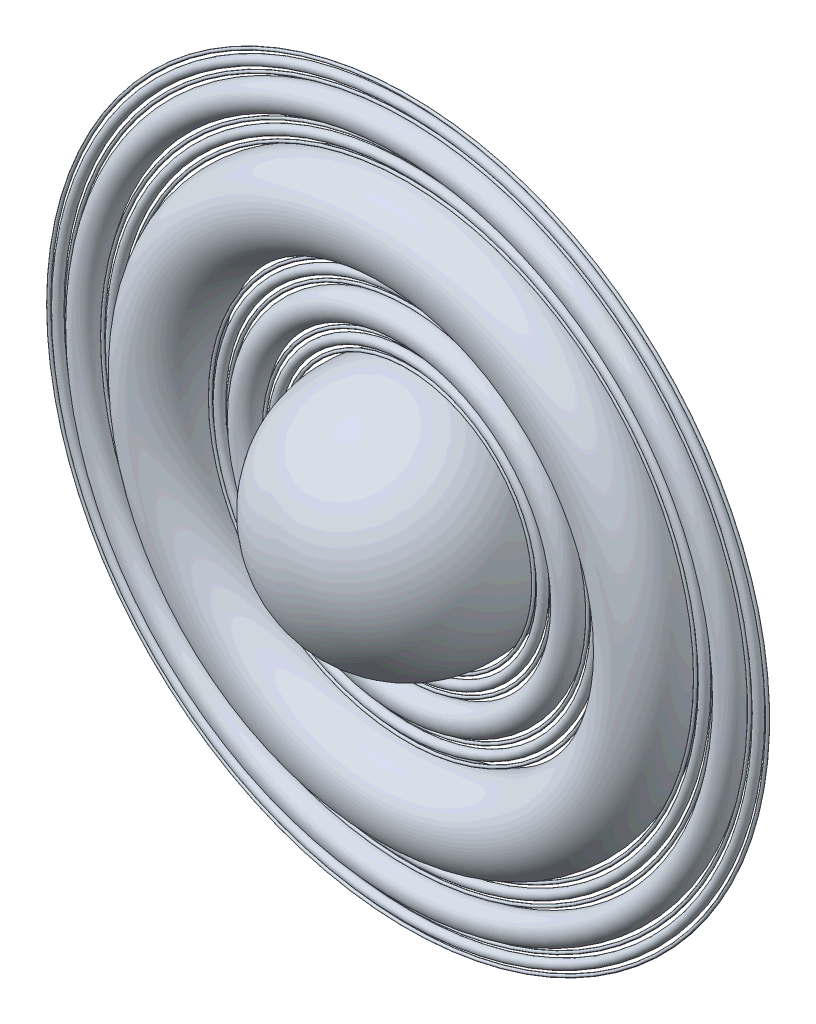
SolidWorks part; units mm, degrees
ref_plane "◯✤ИNⓄᴥ⏀◯✺⦿⚪ꖴ⚪⦿✺◯⏀ᴥⓄИN✤◯" through (0, 0, 0) normal (0, 0, 1) x (1, 0, 0)
ref_plane "◯ߦⓄ✤◯✺⦿⚪ꖴ⚪⦿✺◯✤Ⓞߦ◯" through (0, 0, 0) normal (0, 1, 0) x (1, 0, 0)
ref_plane "◯✤옷ᕤᕦꖴᴥ◯✺⦿⚪ꖴ⚪⦿✺◯ᴥꖴᕤᕦ옷✤◯" through (0, 0, 0) normal (1, 0, 0) x (0, 0, -1)
sketch "◯옷ᑐᑕ✤ᗱᗴ✻ᔓᔕ◯ИNⓄꖴ✤ᑐᑕᗱᗴᔓᔕ◯ᗱᗴᴥᗱᗴ옷ߦᔓᔕ◯✤ИNⓄᴥ⏀◯✺⦿⚪ꖴ⚪⦿✺◯⏀ᴥⓄИN✤◯ᔓᔕߦ옷ᗱᗴᴥᗱᗴ◯ᔓᔕᗱᗴᑐᑕ✤ꖴⓄИN◯ᔓᔕ✻ᗱᗴ✤ᑐᑕ옷◯" plane through (0, 0, 0) normal (0, 0, 1) x (1, 0, 0)
  line L0 (0, 0) -> (0, 0.5) construction
  line L1 (0, 0) -> (0.3536, 0.3536) construction
  line L2 (0, 0) -> (0.5, 0) construction
  line L3 (0, 0) -> (0.3536, -0.3536) construction
  line L4 (0, 0) -> (0, -0.5) construction
  line L5 (0, 0) -> (-0.3536, -0.3536) construction
  line L6 (0, 0) -> (-0.5, 0) construction
  line L7 (0, 0) -> (-0.3536, 0.3536) construction
  circle A0 centre (0, 0) radius 0.5 construction
  point P13 (0, 0)
  dimension "D1" = 8
sketch "◯옷ᑐᑕ✤ᗱᗴ✻ᔓᔕ◯ИNⓄꖴ✤ᑐᑕᗱᗴᔓᔕ◯ᗱᗴᴥᗱᗴ옷ߦᔓᔕ◯✤옷ᕤᕦꖴᴥ◯✺⦿⚪ꖴ⚪⦿✺◯ᴥꖴᕤᕦ옷✤◯ᔓᔕߦ옷ᗱᗴᴥᗱᗴ◯ᔓᔕᗱᗴᑐᑕ✤ꖴⓄИN◯ᔓᔕ✻ᗱᗴ✤ᑐᑕ옷◯" plane through (0, 0, 0) normal (1, 0, 0) x (0, 0, -1)
  line L0 (0, -0.5) -> (0, 0.5) construction
  line L1 (0, 0) -> (-0.5, 0) construction
  line L2 (-0.3536, 0.3536) -> (0, 0) construction
  line L3 (-0.3536, -0.3536) -> (0, 0) construction
  arc A0 (0, 0.5) -> (-0.5, 0) centre (0, 0) ccw construction
  arc A1 (0, -0.5) -> (-0.5, 0) centre (0, 0) cw construction
sketch "◯옷ᑐᑕ✤ᗱᗴ✻ᔓᔕ◯ИNⓄꖴ✤ᑐᑕᗱᗴᔓᔕ◯ᗱᗴᴥᗱᗴ옷ߦᔓᔕ◯ߦⓄ✤◯✺⦿⚪ꖴ⚪⦿✺◯✤Ⓞߦ◯ᔓᔕߦ옷ᗱᗴᴥᗱᗴ◯ᔓᔕᗱᗴᑐᑕ✤ꖴⓄИN◯ᔓᔕ✻ᗱᗴ✤ᑐᑕ옷◯" plane through (0, 0, 0) normal (0, 1, 0) x (1, 0, 0)
  line L0 (0.5, 0) -> (-0.5, 0) construction
  line L1 (0, 0) -> (0, -0.5) construction
  line L2 (-0.3536, -0.3536) -> (0, 0) construction
  line L3 (0.3536, -0.3536) -> (0, 0) construction
  arc A0 (-0.5, 0) -> (0, -0.5) centre (0, 0) ccw construction
  arc A1 (0.5, 0) -> (0, -0.5) centre (0, 0) cw construction
ref_plane "◯✤옷ᕤᕦꖴᴥ◯ߦⓄ✤◯✺⦿⚪ꖴ⚪⦿✺◯✤Ⓞߦ◯ᴥꖴᕤᕦ옷✤◯" through (0, 0, 0) normal (-0.7071, 0.7071, 0) x (0.7071, 0.7071, 0)
ref_plane "◯✤⏀ᗱᗴᙁ◯ߦⓄ✤◯✺⦿⚪ꖴ⚪⦿✺◯✤Ⓞߦ◯ᙁᗱᗴ⏀✤◯" through (0, 0, 0) normal (0.7071, 0.7071, 0) x (0.7071, -0.7071, 0)
ref_plane "◯·◯ߦⓄ✤◯✤ИNⓄᴥ⏀◯✺⦿⚪ꖴ⚪⦿✺◯⏀ᴥⓄИN✤◯✤Ⓞߦ◯·◯" through (0, 0, 0) normal (0, 0.7071, 0.7071) x (1, 0, 0)
ref_plane "◯✤옷ᕤᕦꖴᴥ◯✤ИNⓄᴥ⏀◯✺⦿⚪ꖴ⚪⦿✺◯⏀ᴥⓄИN✤◯ᴥꖴᕤᕦ옷✤◯" through (0, 0, 0) normal (0.7071, 0, 0.7071) x (0.7071, 0, -0.7071)
ref_plane "◯ߦⓄ✤◯✤ИNⓄᴥ⏀◯✺⦿⚪ꖴ⚪⦿✺◯⏀ᴥⓄИN✤◯✤Ⓞߦ◯" through (0, 0, 0) normal (0, -0.7071, 0.7071) x (1, 0, 0)
ref_plane "◯·◯✤옷ᕤᕦꖴᴥ◯✤ИNⓄᴥ⏀◯✺⦿⚪ꖴ⚪⦿✺◯⏀ᴥⓄИN✤◯ᴥꖴᕤᕦ옷✤◯·◯" through (0, 0, 0) normal (-0.7071, 0, 0.7071) x (0.7071, 0, 0.7071)
sketch "◯옷ᑐᑕ✤ᗱᗴ✻ᔓᔕ◯ИNⓄꖴ✤ᑐᑕᗱᗴᔓᔕ◯ᗱᗴᴥᗱᗴ옷ߦᔓᔕ◯·◯ߦⓄ✤◯✤ИNⓄᴥ⏀◯✺⦿⚪ꖴ⚪⦿✺◯⏀ᴥⓄИN✤◯✤Ⓞߦ◯·◯ᔓᔕߦ옷ᗱᗴᴥᗱᗴ◯ᔓᔕᗱᗴᑐᑕ✤ꖴⓄИN◯ᔓᔕ✻ᗱᗴ✤ᑐᑕ옷◯" plane through (0, 0, 0) normal (0, 0.7071, 0.7071) x (1, 0, 0)
  line L0 (-0.2887, -0.4082) -> (0, 0) construction
  line L1 (0.2887, -0.4082) -> (0, 0) construction
  arc A0 (-0.2887, -0.4082) -> (0.2887, -0.4082) centre (0, 0) ccw construction
sketch "◯옷ᑐᑕ✤ᗱᗴ✻ᔓᔕ◯ИNⓄꖴ✤ᑐᑕᗱᗴᔓᔕ◯ᗱᗴᴥᗱᗴ옷ߦᔓᔕ◯✤옷ᕤᕦꖴᴥ◯✤ИNⓄᴥ⏀◯✺⦿⚪ꖴ⚪⦿✺◯⏀ᴥⓄИN✤◯ᴥꖴᕤᕦ옷✤◯ᔓᔕߦ옷ᗱᗴᴥᗱᗴ◯ᔓᔕᗱᗴᑐᑕ✤ꖴⓄИN◯ᔓᔕ✻ᗱᗴ✤ᑐᑕ옷◯" plane through (0, 0, 0) normal (0.7071, 0, 0.7071) x (0.7071, 0, -0.7071)
  line L0 (-0.4082, -0.2887) -> (0, 0) construction
  line L1 (-0.4082, -0.2887) -> (0, 0) construction
  line L2 (-0.4082, 0.2887) -> (0, 0) construction
  arc A0 (-0.4082, 0.2887) -> (-0.4082, -0.2887) centre (0, 0) ccw construction
sketch "◯옷ᑐᑕ✤ᗱᗴ✻ᔓᔕ◯ИNⓄꖴ✤ᑐᑕᗱᗴᔓᔕ◯ᗱᗴᴥᗱᗴ옷ߦᔓᔕ◯ߦⓄ✤◯✤ИNⓄᴥ⏀◯✺⦿⚪ꖴ⚪⦿✺◯⏀ᴥⓄИN✤◯✤Ⓞߦ◯ᔓᔕߦ옷ᗱᗴᴥᗱᗴ◯ᔓᔕᗱᗴᑐᑕ✤ꖴⓄИN◯ᔓᔕ✻ᗱᗴ✤ᑐᑕ옷◯" plane through (0, 0, 0) normal (0, -0.7071, 0.7071) x (1, 0, 0)
  line L0 (-0.2887, 0.4082) -> (0, 0) construction
  line L1 (-0.2887, 0.4082) -> (0, 0) construction
  line L2 (0.2887, 0.4082) -> (0, 0) construction
  arc A0 (0.2887, 0.4082) -> (-0.2887, 0.4082) centre (0, 0) ccw construction
sketch "◯옷ᑐᑕ✤ᗱᗴ✻ᔓᔕ◯ИNⓄꖴ✤ᑐᑕᗱᗴᔓᔕ◯ᗱᗴᴥᗱᗴ옷ߦᔓᔕ◯·◯✤옷ᕤᕦꖴᴥ◯✤ИNⓄᴥ⏀◯✺⦿⚪ꖴ⚪⦿✺◯⏀ᴥⓄИN✤◯ᴥꖴᕤᕦ옷✤◯·◯ᔓᔕߦ옷ᗱᗴᴥᗱᗴ◯ᔓᔕᗱᗴᑐᑕ✤ꖴⓄИN◯ᔓᔕ✻ᗱᗴ✤ᑐᑕ옷◯" plane through (0, 0, 0) normal (-0.7071, 0, 0.7071) x (0.7071, 0, 0.7071)
  line L0 (0.4082, 0.2887) -> (0, 0) construction
  line L1 (0.4082, -0.2887) -> (0, 0) construction
  line L2 (0.4082, 0.2887) -> (0, 0) construction
  line L3 (0.4082, -0.2887) -> (0, 0) construction
  arc A0 (0.4082, -0.2887) -> (0.4082, 0.2887) centre (0, 0) ccw construction
other "Freeze***"
sketch "Sketch0" plane through (0, 0, 0) normal (0, 0, 1) x (1, 0, 0)
  line L0 (3280.5, 0) -> (-3280.5, 0)
  arc A0 (3280.5, 0) -> (-3280.5, 0) centre (0, 0) ccw
revolve "0" add sketch "Sketch0" angle 360 about L0
sketch "Sketch730" plane through (0, 0, 0) normal (0, 1, 0) x (1, 0, 0)
  line L4 (0, 5467.5) -> (0, 7654.5) construction
  circle A3 centre (6561, 0) radius 1093.5
revolve "0 +1" add sketch "Sketch730" angle 360 about L4
sketch "Sketch731" plane through (0, 0, 0) normal (0, 1, 0) x (1, 0, 0)
  line L6 (0, 4738.5) -> (0, 4009.5) construction
  circle A3 centre (4374, 0) radius 364.5
  point P4 (0, 0)
revolve "2 -1" add sketch "Sketch731" angle 360 about L6
sketch "Sketch732" plane through (0, 0, 0) normal (0, 1, 0) x (1, 0, 0)
  line L4 (0, 9112.5) -> (0, 8383.5) construction
  circle A3 centre (8748, 0) radius 364.5
revolve "2 +1" add sketch "Sketch732" angle 360 about L4
sketch "Sketch733" plane through (0, 0, 0) normal (0, 1, 0) x (1, 0, 0)
  line L4 (0, 3766.5) -> (0, 3523.5) construction
  circle A3 centre (3645, 0) radius 121.5
  point P1 (0, 0)
revolve "3 -2 -1" add sketch "Sketch733" angle 360 about L4
sketch "Sketch734" plane through (0, 0, 0) normal (0, 1, 0) x (1, 0, 0)
  line L4 (0, 5224.5) -> (0, 4981.5) construction
  circle A3 centre (5103, 0) radius 121.5
revolve "3 +2 -1" add sketch "Sketch734" angle 360 about L4
sketch "Sketch735" plane through (0, 0, 0) normal (0, 1, 0) x (1, 0, 0)
  line L4 (0, 8140.5) -> (0, 7897.5) construction
  circle A3 centre (8019, 0) radius 121.5
revolve "3 -2 +1" add sketch "Sketch735" angle 360 about L4
sketch "Sketch736" plane through (0, 0, 0) normal (0, 1, 0) x (1, 0, 0)
  line L4 (0, 9598.5) -> (0, 9355.5) construction
  circle A3 centre (9477, 0) radius 121.5
revolve "3 +2 +1" add sketch "Sketch736" angle 360 about L4
sketch "Sketch737" plane through (0, 0, 0) normal (0, 1, 0) x (1, 0, 0)
  line L4 (0, 3442.5) -> (0, 3361.5) construction
  circle A3 centre (3402, 0) radius 40.5
revolve "4 -3 -2 -1" add sketch "Sketch737" angle 360 about L4
sketch "Sketch738" plane through (0, 0, 0) normal (0, 1, 0) x (1, 0, 0)
  line L4 (0, 3928.5) -> (0, 3847.5) construction
  circle A3 centre (3888, 0) radius 40.5
revolve "4 +3 -2 -1" add sketch "Sketch738" angle 360 about L4
sketch "Sketch739" plane through (0, 0, 0) normal (0, 1, 0) x (1, 0, 0)
  line L4 (0, 4900.5) -> (0, 4819.5) construction
  circle A3 centre (4860, 0) radius 40.5
revolve "4 -3 +2 -1" add sketch "Sketch739" angle 360 about L4
sketch "Sketch740" plane through (0, 0, 0) normal (0, 1, 0) x (1, 0, 0)
  line L4 (0, 5386.5) -> (0, 5305.5) construction
  circle A3 centre (5346, 0) radius 40.5
revolve "4 +3 +2 -1" add sketch "Sketch740" angle 360 about L4
sketch "Sketch741" plane through (0, 0, 0) normal (0, 1, 0) x (1, 0, 0)
  line L4 (0, 7816.5) -> (0, 7735.5) construction
  circle A3 centre (7776, 0) radius 40.5
revolve "4 -3 -2 +1" add sketch "Sketch741" angle 360 about L4
sketch "Sketch742" plane through (0, 0, 0) normal (0, 1, 0) x (1, 0, 0)
  line L4 (0, 8302.5) -> (0, 8221.5) construction
  circle A3 centre (8262, 0) radius 40.5
revolve "4 +3 -2 +1" add sketch "Sketch742" angle 360 about L4
sketch "Sketch743" plane through (0, 0, 0) normal (0, 1, 0) x (1, 0, 0)
  line L4 (0, 9274.5) -> (0, 9193.5) construction
  circle A3 centre (9234, 0) radius 40.5
revolve "4 -3 +2 +1" add sketch "Sketch743" angle 360 about L4
sketch "Sketch744" plane through (0, 0, 0) normal (0, 1, 0) x (1, 0, 0)
  line L4 (0, 9760.5) -> (0, 9679.5) construction
  circle A3 centre (9720, 0) radius 40.5
revolve "4 +3 +2 +1" add sketch "Sketch744" angle 360 about L4
sketch "Sketch1" plane through (0, 0, 0) normal (0, 0, 1) x (1, 0, 0)
  circle A0 centre (0, 0) radius 3280.5
  circle A1 centre (0, 0) radius 9841.5
extrude "Boss-Extrude1" [suppressed] add sketch "Sketch1" along normal mid plane 1 separate body
sketch "Sketch3" plane through (0, 0, 0) normal (0, 0, 1) x (1, 0, 0)
  circle A2 centre (0, 0) radius 9841.5 construction
  circle A3 centre (0, 0) radius 3280.5 construction
  circle A4 centre (0, 0) radius 6561 construction
  circle A5 centre (0, 0) radius 7654.5
  circle A6 centre (0, 0) radius 5467.5
extrude "Boss-Extrude3" [suppressed] add sketch "Sketch3" along normal mid plane 3 separate body
sketch "Sketch9" [suppressed] plane through (0, 0, 0) normal (0, 0, 1) x (1, 0, 0)
  line L0 (-3280.5, 0) -> (-5467.5, 0) construction
  line L1 (-7654.5, 0) -> (-9841.5, 0) construction
  circle A0 centre (0, 0) radius 5467.5 construction
  circle A1 centre (0, 0) radius 7654.5
  circle A2 centre (0, 0) radius 7654.5 construction
  circle A3 centre (0, 0) radius 5467.5 construction
  circle A4 centre (0, 0) radius 3280.5 construction
  circle A5 centre (0, 0) radius 3280.5 construction
  circle A6 centre (0, 0) radius 9841.5 construction
  circle A7 centre (0, 0) radius 4374 construction
  circle A8 centre (0, 0) radius 8748 construction
  circle A9 centre (0, 0) radius 4738.5
  circle A10 centre (0, 0) radius 9112.5
  circle A11 centre (0, 0) radius 4009.5
  circle A12 centre (0, 0) radius 8383.5
  point P15 (-4374, 0)
  point P16 (-8748, 0)
  dimension "D1" = 0
extrude "Boss-Extrude9" [suppressed] add sketch "Sketch9" along normal mid plane 9 separate body contours A9 A11 | A10 A12
sketch "Sketch27" [suppressed] plane through (0, 0, 0) normal (0, 0, 1) x (1, 0, 0)
  line L0 (-7654.5, 0) -> (-8383.5, 0) construction
  line L1 (-9112.5, 0) -> (-9841.5, 0) construction
  line L2 (-4738.5, 0) -> (-5467.5, 0) construction
  line L3 (-3280.5, 0) -> (-4009.5, 0) construction
  circle A0 centre (0, 0) radius 8383.5 construction
  circle A1 centre (0, 0) radius 9112.5 construction
  circle A2 centre (0, 0) radius 8383.5 construction
  circle A3 centre (0, 0) radius 9112.5 construction
  circle A4 centre (0, 0) radius 4009.5 construction
  circle A5 centre (0, 0) radius 4738.5 construction
  circle A6 centre (0, 0) radius 4009.5 construction
  circle A7 centre (0, 0) radius 4738.5 construction
  circle A8 centre (0, 0) radius 9841.5 construction
  circle A9 centre (0, 0) radius 9841.5 construction
  circle A10 centre (0, 0) radius 7654.5 construction
  circle A11 centre (0, 0) radius 7654.5 construction
  circle A12 centre (0, 0) radius 3280.5 construction
  circle A13 centre (0, 0) radius 5467.5 construction
  circle A14 centre (0, 0) radius 3280.5 construction
  circle A15 centre (0, 0) radius 5467.5 construction
  circle A16 centre (0, 0) radius 3645 construction
  circle A17 centre (0, 0) radius 5103 construction
  circle A18 centre (0, 0) radius 8019 construction
  circle A19 centre (0, 0) radius 9477 construction
  circle A20 centre (0, 0) radius 3766.5
  circle A21 centre (0, 0) radius 5224.5
  circle A22 centre (0, 0) radius 8140.5
  circle A23 centre (0, 0) radius 9598.5
  circle A24 centre (0, 0) radius 3523.5
  circle A25 centre (0, 0) radius 4981.5
  circle A26 centre (0, 0) radius 7897.5
  circle A27 centre (0, 0) radius 9355.5
  point P28 (-8019, 0)
  point P29 (-9477, 0)
  point P34 (-3645, 0)
  point P35 (-5103, 0)
extrude "Boss-Extrude27" [suppressed] add sketch "Sketch27" along normal mid plane 27 separate body contours A20 A24 | A21 A25 | A22 A26 | A23 A27
sketch "Sketch81" [suppressed] plane through (0, 0, 0) normal (0, 0, 1) x (1, 0, 0)
  line L0 (-3280.5, 0) -> (-3523.5, 0) construction
  line L1 (-3766.5, 0) -> (-4009.5, 0) construction
  line L2 (-4738.5, 0) -> (-4981.5, 0) construction
  line L3 (-5224.5, 0) -> (-5467.5, 0) construction
  line L4 (-7654.5, 0) -> (-7897.5, 0) construction
  line L5 (-8140.5, 0) -> (-8383.5, 0) construction
  line L6 (-9112.5, 0) -> (-9355.5, 0) construction
  line L7 (-9598.5, 0) -> (-9841.5, 0) construction
  circle A0 centre (0, 0) radius 3523.5 construction
  circle A1 centre (0, 0) radius 3280.5 construction
  circle A2 centre (0, 0) radius 3523.5 construction
  circle A3 centre (0, 0) radius 3280.5 construction
  circle A4 centre (0, 0) radius 3402 construction
  circle A5 centre (0, 0) radius 4009.5 construction
  circle A6 centre (0, 0) radius 3766.5 construction
  circle A7 centre (0, 0) radius 4009.5 construction
  circle A8 centre (0, 0) radius 3766.5 construction
  circle A9 centre (0, 0) radius 3888 construction
  circle A10 centre (0, 0) radius 4981.5 construction
  circle A11 centre (0, 0) radius 4738.5 construction
  circle A12 centre (0, 0) radius 4981.5 construction
  circle A13 centre (0, 0) radius 4738.5 construction
  circle A15 centre (0, 0) radius 4860 construction
  circle A16 centre (0, 0) radius 5467.5 construction
  circle A17 centre (0, 0) radius 5224.5 construction
  circle A18 centre (0, 0) radius 5467.5 construction
  circle A19 centre (0, 0) radius 5224.5 construction
  circle A20 centre (0, 0) radius 5346 construction
  circle A21 centre (0, 0) radius 7897.5 construction
  circle A22 centre (0, 0) radius 7654.5 construction
  circle A23 centre (0, 0) radius 7897.5 construction
  circle A24 centre (0, 0) radius 7654.5 construction
  circle A25 centre (0, 0) radius 8383.5 construction
  circle A26 centre (0, 0) radius 8140.5 construction
  circle A27 centre (0, 0) radius 8383.5 construction
  circle A28 centre (0, 0) radius 8140.5 construction
  circle A29 centre (0, 0) radius 9355.5 construction
  circle A30 centre (0, 0) radius 9112.5 construction
  circle A31 centre (0, 0) radius 9355.5 construction
  circle A32 centre (0, 0) radius 9112.5 construction
  circle A33 centre (0, 0) radius 9841.5 construction
  circle A34 centre (0, 0) radius 9598.5 construction
  circle A35 centre (0, 0) radius 9841.5 construction
  circle A36 centre (0, 0) radius 9598.5 construction
  circle A37 centre (0, 0) radius 7776 construction
  circle A38 centre (0, 0) radius 8262 construction
  circle A39 centre (0, 0) radius 9234 construction
  circle A40 centre (0, 0) radius 9720 construction
  circle A41 centre (0, 0) radius 3442.5
  circle A42 centre (0, 0) radius 3928.5
  circle A43 centre (0, 0) radius 4900.5
  circle A44 centre (0, 0) radius 5386.5
  circle A45 centre (0, 0) radius 7816.5
  circle A46 centre (0, 0) radius 8302.5
  circle A47 centre (0, 0) radius 9274.5
  circle A48 centre (0, 0) radius 9760.5
  circle A49 centre (0, 0) radius 3361.5
  circle A50 centre (0, 0) radius 3847.5
  circle A51 centre (0, 0) radius 4819.5
  circle A52 centre (0, 0) radius 5305.5
  circle A53 centre (0, 0) radius 7735.5
  circle A54 centre (0, 0) radius 8221.5
  circle A55 centre (0, 0) radius 9193.5
  circle A56 centre (0, 0) radius 9679.5
  point P8 (-3402, 0)
  point P18 (-3888, 0)
  point P28 (-4860, 0)
  point P38 (-5346, 0)
  point P48 (-7776, 0)
  point P57 (-8262, 0)
  point P66 (-9234, 0)
  point P75 (-9720, 0)
extrude "Boss-Extrude81" [suppressed] add sketch "Sketch81" along normal mid plane 81 separate body contours A41 A49 | A42 A50 | A43 A51 | A44 A52 | A45 A53 | A46 A54 | A47 A55 | A48 A56
sketch "Sketch243" [suppressed] plane through (0, 0, 0) normal (0, 0, 1) x (1, 0, 0)
  line L0 (-3280.5, 0) -> (-3361.5, 0) construction
  line L1 (-3442.5, 0) -> (-3523.5, 0) construction
  line L2 (-3766.5, 0) -> (-3847.5, 0) construction
  line L3 (-3928.5, 0) -> (-4009.5, 0) construction
  line L4 (-4738.5, 0) -> (-4819.5, 0) construction
  line L5 (-4900.5, 0) -> (-4981.5, 0) construction
  line L6 (-5224.5, 0) -> (-5305.5, 0) construction
  line L7 (-5386.5, 0) -> (-5467.5, 0) construction
  line L8 (-7654.5, 0) -> (-7735.5, 0) construction
  line L9 (-7816.5, 0) -> (-7897.5, 0) construction
  line L10 (-8140.5, 0) -> (-8221.5, 0) construction
  line L11 (-8302.5, 0) -> (-8383.5, 0) construction
  line L12 (-9112.5, 0) -> (-9193.5, 0) construction
  line L13 (-9274.5, 0) -> (-9355.5, 0) construction
  line L14 (-9598.5, 0) -> (-9679.5, 0) construction
  line L15 (-9760.5, 0) -> (-9841.5, 0) construction
  circle A0 centre (0, 0) radius 3361.5 construction
  circle A1 centre (0, 0) radius 3280.5 construction
  circle A2 centre (0, 0) radius 3361.5 construction
  circle A3 centre (0, 0) radius 3280.5 construction
  circle A4 centre (0, 0) radius 3523.5 construction
  circle A5 centre (0, 0) radius 3442.5 construction
  circle A6 centre (0, 0) radius 3523.5 construction
  circle A7 centre (0, 0) radius 3442.5 construction
  circle A8 centre (0, 0) radius 3847.5 construction
  circle A9 centre (0, 0) radius 3766.5 construction
  circle A10 centre (0, 0) radius 3847.5 construction
  circle A11 centre (0, 0) radius 3766.5 construction
  circle A12 centre (0, 0) radius 4009.5 construction
  circle A13 centre (0, 0) radius 3928.5 construction
  circle A14 centre (0, 0) radius 4009.5 construction
  circle A15 centre (0, 0) radius 3928.5 construction
  circle A16 centre (0, 0) radius 4819.5 construction
  circle A17 centre (0, 0) radius 4738.5 construction
  circle A18 centre (0, 0) radius 4819.5 construction
  circle A19 centre (0, 0) radius 4738.5 construction
  circle A20 centre (0, 0) radius 4981.5 construction
  circle A21 centre (0, 0) radius 4900.5 construction
  circle A22 centre (0, 0) radius 4981.5 construction
  circle A23 centre (0, 0) radius 4900.5 construction
  circle A24 centre (0, 0) radius 5467.5 construction
  circle A25 centre (0, 0) radius 5386.5 construction
  circle A26 centre (0, 0) radius 5305.5 construction
  circle A27 centre (0, 0) radius 5224.5 construction
  circle A28 centre (0, 0) radius 5467.5 construction
  circle A29 centre (0, 0) radius 5386.5 construction
  circle A30 centre (0, 0) radius 5305.5 construction
  circle A31 centre (0, 0) radius 5224.5 construction
  circle A32 centre (0, 0) radius 7735.5 construction
  circle A33 centre (0, 0) radius 7654.5 construction
  circle A34 centre (0, 0) radius 7735.5 construction
  circle A35 centre (0, 0) radius 7654.5 construction
  circle A36 centre (0, 0) radius 8383.5 construction
  circle A37 centre (0, 0) radius 8302.5 construction
  circle A38 centre (0, 0) radius 8221.5 construction
  circle A39 centre (0, 0) radius 8140.5 construction
  circle A40 centre (0, 0) radius 7897.5 construction
  circle A41 centre (0, 0) radius 7816.5 construction
  circle A42 centre (0, 0) radius 8383.5 construction
  circle A43 centre (0, 0) radius 8302.5 construction
  circle A44 centre (0, 0) radius 8221.5 construction
  circle A45 centre (0, 0) radius 8140.5 construction
  circle A46 centre (0, 0) radius 7897.5 construction
  circle A47 centre (0, 0) radius 7816.5 construction
  circle A48 centre (0, 0) radius 9760.5 construction
  circle A49 centre (0, 0) radius 9841.5
  circle A50 centre (0, 0) radius 9841.5 construction
  circle A51 centre (0, 0) radius 9679.5 construction
  circle A52 centre (0, 0) radius 9598.5 construction
  circle A53 centre (0, 0) radius 9355.5 construction
  circle A54 centre (0, 0) radius 9274.5 construction
  circle A55 centre (0, 0) radius 9193.5 construction
  circle A56 centre (0, 0) radius 9112.5 construction
  circle A57 centre (0, 0) radius 9760.5 construction
  circle A58 centre (0, 0) radius 9679.5 construction
  circle A59 centre (0, 0) radius 9598.5 construction
  circle A60 centre (0, 0) radius 9355.5 construction
  circle A61 centre (0, 0) radius 9274.5 construction
  circle A62 centre (0, 0) radius 9193.5 construction
  circle A63 centre (0, 0) radius 9112.5 construction
  circle A64 centre (0, 0) radius 3321 construction
  circle A65 centre (0, 0) radius 3483 construction
  circle A66 centre (0, 0) radius 3807 construction
  circle A67 centre (0, 0) radius 3969 construction
  circle A68 centre (0, 0) radius 4779 construction
  circle A69 centre (0, 0) radius 4941 construction
  circle A70 centre (0, 0) radius 5265 construction
  circle A71 centre (0, 0) radius 5427 construction
  circle A72 centre (0, 0) radius 7695 construction
  circle A73 centre (0, 0) radius 7857 construction
  circle A74 centre (0, 0) radius 8181 construction
  circle A75 centre (0, 0) radius 8343 construction
  circle A76 centre (0, 0) radius 9153 construction
  circle A77 centre (0, 0) radius 9315 construction
  circle A78 centre (0, 0) radius 9639 construction
  circle A79 centre (0, 0) radius 9801 construction
  circle A80 centre (0, 0) radius 3334.5
  circle A81 centre (0, 0) radius 3496.5
  circle A82 centre (0, 0) radius 3820.5
  circle A83 centre (0, 0) radius 3982.5
  circle A84 centre (0, 0) radius 4792.5
  circle A85 centre (0, 0) radius 4954.5
  circle A86 centre (0, 0) radius 5278.5
  circle A87 centre (0, 0) radius 5440.5
  circle A88 centre (0, 0) radius 7708.5
  circle A89 centre (0, 0) radius 7870.5
  circle A90 centre (0, 0) radius 8194.5
  circle A91 centre (0, 0) radius 8356.5
  circle A92 centre (0, 0) radius 9166.5
  circle A93 centre (0, 0) radius 9328.5
  circle A94 centre (0, 0) radius 9652.5
  circle A95 centre (0, 0) radius 9814.5
  circle A96 centre (0, 0) radius 3307.5
  circle A97 centre (0, 0) radius 3469.5
  circle A98 centre (0, 0) radius 3793.5
  circle A99 centre (0, 0) radius 3955.5
  circle A100 centre (0, 0) radius 4765.5
  circle A101 centre (0, 0) radius 4927.5
  circle A102 centre (0, 0) radius 5251.5
  circle A103 centre (0, 0) radius 5413.5
  circle A104 centre (0, 0) radius 7681.5
  circle A105 centre (0, 0) radius 7843.5
  circle A106 centre (0, 0) radius 8167.5
  circle A107 centre (0, 0) radius 8329.5
  circle A108 centre (0, 0) radius 9139.5
  circle A109 centre (0, 0) radius 9301.5
  circle A110 centre (0, 0) radius 9625.5
  circle A111 centre (0, 0) radius 9787.5
  point P8 (-3321, 0)
  point P17 (-3483, 0)
  point P26 (-3807, 0)
  point P35 (-3969, 0)
  point P68 (-4779, 0)
  point P69 (-4941, 0)
  point P70 (-5265, 0)
  point P71 (-5427, 0)
  point P136 (-7695, 0)
  point P137 (-7857, 0)
  point P138 (-8181, 0)
  point P139 (-8343, 0)
  point P140 (-9153, 0)
  point P141 (-9315, 0)
  point P142 (-9639, 0)
  point P143 (-9801, 0)
  dimension "D1" = 0
extrude "Boss-Extrude243" [suppressed] add sketch "Sketch243" along normal mid plane 243 separate body contours A80 A96 | A81 A97 | A82 A98 | A83 A99 | A84 A100 | A85 A101 | A86 A102 | A87 A103 | A88 A104 | A89 A105 | A90 A106 | A91 A107 | A92 A108 | A93 A109 | A94 A110 | A95 A111
sketch "Sketch729" [suppressed] plane through (0, 0, 0) normal (0, 0, 1) x (1, 0, 0)
  line L0 (-3280.5, 0) -> (-3307.5, 0) construction
  line L1 (-3334.5, 0) -> (-3361.5, 0) construction
  line L2 (-3442.5, 0) -> (-3469.5, 0) construction
  line L3 (-3496.5, 0) -> (-3523.5, 0) construction
  line L4 (-3766.5, 0) -> (-3793.5, 0) construction
  line L5 (-3820.5, 0) -> (-3847.5, 0) construction
  line L6 (-3928.5, 0) -> (-3955.5, 0) construction
  line L7 (-3982.5, 0) -> (-4009.5, 0) construction
  line L8 (-4738.5, 0) -> (-4765.5, 0) construction
  line L9 (-4792.5, 0) -> (-4819.5, 0) construction
  line L10 (-4900.5, 0) -> (-4927.5, 0) construction
  line L11 (-4954.5, 0) -> (-4981.5, 0) construction
  line L12 (-5224.5, 0) -> (-5251.5, 0) construction
  line L13 (-5278.5, 0) -> (-5305.5, 0) construction
  line L14 (-5386.5, 0) -> (-5413.5, 0) construction
  line L15 (-5440.5, 0) -> (-5467.5, 0) construction
  line L16 (-7654.5, 0) -> (-7681.5, 0) construction
  line L17 (-7708.5, 0) -> (-7735.5, 0) construction
  line L18 (-7816.5, 0) -> (-7843.5, 0) construction
  line L19 (-7870.5, 0) -> (-7897.5, 0) construction
  line L20 (-8140.5, 0) -> (-8167.5, 0) construction
  line L21 (-8194.5, 0) -> (-8221.5, 0) construction
  line L22 (-8302.5, 0) -> (-8329.5, 0) construction
  line L23 (-8356.5, 0) -> (-8383.5, 0) construction
  line L24 (-9112.5, 0) -> (-9139.5, 0) construction
  line L25 (-9166.5, 0) -> (-9193.5, 0) construction
  line L26 (-9274.5, 0) -> (-9301.5, 0) construction
  line L27 (-9328.5, 0) -> (-9355.5, 0) construction
  line L28 (-9598.5, 0) -> (-9625.5, 0) construction
  line L29 (-9652.5, 0) -> (-9679.5, 0) construction
  line L30 (-9760.5, 0) -> (-9787.5, 0) construction
  line L31 (-9814.5, 0) -> (-9841.5, 0) construction
  circle A0 centre (0, 0) radius 4009.5 construction
  circle A1 centre (0, 0) radius 3280.5
  circle A2 centre (0, 0) radius 3280.5 construction
  circle A3 centre (0, 0) radius 3982.5 construction
  circle A4 centre (0, 0) radius 3955.5 construction
  circle A5 centre (0, 0) radius 3928.5 construction
  circle A6 centre (0, 0) radius 3847.5 construction
  circle A7 centre (0, 0) radius 3820.5 construction
  circle A8 centre (0, 0) radius 3793.5 construction
  circle A9 centre (0, 0) radius 3766.5 construction
  circle A10 centre (0, 0) radius 3523.5 construction
  circle A11 centre (0, 0) radius 3496.5 construction
  circle A12 centre (0, 0) radius 3469.5 construction
  circle A13 centre (0, 0) radius 3442.5 construction
  circle A14 centre (0, 0) radius 3361.5 construction
  circle A15 centre (0, 0) radius 3334.5 construction
  circle A16 centre (0, 0) radius 3307.5 construction
  circle A17 centre (0, 0) radius 4009.5 construction
  circle A18 centre (0, 0) radius 3982.5 construction
  circle A19 centre (0, 0) radius 3955.5 construction
  circle A20 centre (0, 0) radius 3928.5 construction
  circle A21 centre (0, 0) radius 3847.5 construction
  circle A22 centre (0, 0) radius 3820.5 construction
  circle A23 centre (0, 0) radius 3793.5 construction
  circle A24 centre (0, 0) radius 3766.5 construction
  circle A25 centre (0, 0) radius 3523.5 construction
  circle A26 centre (0, 0) radius 3496.5 construction
  circle A27 centre (0, 0) radius 3469.5 construction
  circle A28 centre (0, 0) radius 3442.5 construction
  circle A29 centre (0, 0) radius 3361.5 construction
  circle A30 centre (0, 0) radius 3334.5 construction
  circle A31 centre (0, 0) radius 3307.5 construction
  circle A32 centre (0, 0) radius 5467.5 construction
  circle A33 centre (0, 0) radius 9841.5
  circle A34 centre (0, 0) radius 9841.5 construction
  circle A35 centre (0, 0) radius 5440.5 construction
  circle A36 centre (0, 0) radius 5413.5 construction
  circle A37 centre (0, 0) radius 5386.5 construction
  circle A38 centre (0, 0) radius 5305.5 construction
  circle A39 centre (0, 0) radius 5278.5 construction
  circle A40 centre (0, 0) radius 5251.5 construction
  circle A41 centre (0, 0) radius 5224.5 construction
  circle A42 centre (0, 0) radius 4981.5 construction
  circle A43 centre (0, 0) radius 4954.5 construction
  circle A44 centre (0, 0) radius 4927.5 construction
  circle A45 centre (0, 0) radius 4900.5 construction
  circle A46 centre (0, 0) radius 4819.5 construction
  circle A47 centre (0, 0) radius 4792.5 construction
  circle A48 centre (0, 0) radius 4765.5 construction
  circle A49 centre (0, 0) radius 4738.5 construction
  circle A50 centre (0, 0) radius 5467.5 construction
  circle A51 centre (0, 0) radius 5440.5 construction
  circle A52 centre (0, 0) radius 5413.5 construction
  circle A53 centre (0, 0) radius 5386.5 construction
  circle A54 centre (0, 0) radius 5305.5 construction
  circle A55 centre (0, 0) radius 5278.5 construction
  circle A56 centre (0, 0) radius 5251.5 construction
  circle A57 centre (0, 0) radius 5224.5 construction
  circle A58 centre (0, 0) radius 4981.5 construction
  circle A59 centre (0, 0) radius 4954.5 construction
  circle A60 centre (0, 0) radius 4927.5 construction
  circle A61 centre (0, 0) radius 4900.5 construction
  circle A62 centre (0, 0) radius 4819.5 construction
  circle A63 centre (0, 0) radius 4792.5 construction
  circle A64 centre (0, 0) radius 4765.5 construction
  circle A65 centre (0, 0) radius 4738.5 construction
  circle A66 centre (0, 0) radius 8383.5 construction
  circle A67 centre (0, 0) radius 9814.5 construction
  circle A68 centre (0, 0) radius 3294 construction
  circle A69 centre (0, 0) radius 8356.5 construction
  circle A70 centre (0, 0) radius 8329.5 construction
  circle A71 centre (0, 0) radius 8302.5 construction
  circle A72 centre (0, 0) radius 8221.5 construction
  circle A73 centre (0, 0) radius 8194.5 construction
  circle A74 centre (0, 0) radius 8167.5 construction
  circle A75 centre (0, 0) radius 8140.5 construction
  circle A76 centre (0, 0) radius 7897.5 construction
  circle A77 centre (0, 0) radius 7870.5 construction
  circle A78 centre (0, 0) radius 7843.5 construction
  circle A79 centre (0, 0) radius 7816.5 construction
  circle A80 centre (0, 0) radius 7735.5 construction
  circle A81 centre (0, 0) radius 7708.5 construction
  circle A82 centre (0, 0) radius 7681.5 construction
  circle A83 centre (0, 0) radius 7654.5 construction
  circle A84 centre (0, 0) radius 8383.5 construction
  circle A85 centre (0, 0) radius 8356.5 construction
  circle A86 centre (0, 0) radius 8329.5 construction
  circle A87 centre (0, 0) radius 8302.5 construction
  circle A88 centre (0, 0) radius 8221.5 construction
  circle A89 centre (0, 0) radius 8194.5 construction
  circle A90 centre (0, 0) radius 8167.5 construction
  circle A91 centre (0, 0) radius 8140.5 construction
  circle A92 centre (0, 0) radius 7897.5 construction
  circle A93 centre (0, 0) radius 7870.5 construction
  circle A94 centre (0, 0) radius 7843.5 construction
  circle A95 centre (0, 0) radius 7816.5 construction
  circle A96 centre (0, 0) radius 7735.5 construction
  circle A97 centre (0, 0) radius 7708.5 construction
  circle A98 centre (0, 0) radius 7681.5 construction
  circle A99 centre (0, 0) radius 7654.5 construction
  circle A100 centre (0, 0) radius 3348 construction
  circle A101 centre (0, 0) radius 9787.5 construction
  circle A102 centre (0, 0) radius 9760.5 construction
  circle A103 centre (0, 0) radius 9679.5 construction
  circle A104 centre (0, 0) radius 9652.5 construction
  circle A105 centre (0, 0) radius 9625.5 construction
  circle A106 centre (0, 0) radius 9598.5 construction
  circle A107 centre (0, 0) radius 9355.5 construction
  circle A108 centre (0, 0) radius 9328.5 construction
  circle A109 centre (0, 0) radius 9301.5 construction
  circle A110 centre (0, 0) radius 9274.5 construction
  circle A111 centre (0, 0) radius 9193.5 construction
  circle A112 centre (0, 0) radius 9166.5 construction
  circle A113 centre (0, 0) radius 9139.5 construction
  circle A114 centre (0, 0) radius 9112.5 construction
  circle A115 centre (0, 0) radius 9814.5 construction
  circle A116 centre (0, 0) radius 9787.5 construction
  circle A117 centre (0, 0) radius 9760.5 construction
  circle A118 centre (0, 0) radius 9679.5 construction
  circle A119 centre (0, 0) radius 9652.5 construction
  circle A120 centre (0, 0) radius 9625.5 construction
  circle A121 centre (0, 0) radius 9598.5 construction
  circle A122 centre (0, 0) radius 9355.5 construction
  circle A123 centre (0, 0) radius 9328.5 construction
  circle A124 centre (0, 0) radius 9301.5 construction
  circle A125 centre (0, 0) radius 9274.5 construction
  circle A126 centre (0, 0) radius 9193.5 construction
  circle A127 centre (0, 0) radius 9166.5 construction
  circle A128 centre (0, 0) radius 9139.5 construction
  circle A129 centre (0, 0) radius 9112.5 construction
  circle A130 centre (0, 0) radius 3456 construction
  circle A131 centre (0, 0) radius 3510 construction
  circle A132 centre (0, 0) radius 3780 construction
  circle A133 centre (0, 0) radius 3834 construction
  circle A134 centre (0, 0) radius 3942 construction
  circle A135 centre (0, 0) radius 3996 construction
  circle A136 centre (0, 0) radius 4752 construction
  circle A137 centre (0, 0) radius 4806 construction
  circle A138 centre (0, 0) radius 4914 construction
  circle A139 centre (0, 0) radius 4968 construction
  circle A140 centre (0, 0) radius 5238 construction
  circle A141 centre (0, 0) radius 5292 construction
  circle A142 centre (0, 0) radius 5400 construction
  circle A143 centre (0, 0) radius 5454 construction
  circle A144 centre (0, 0) radius 7668 construction
  circle A145 centre (0, 0) radius 7722 construction
  circle A146 centre (0, 0) radius 7830 construction
  circle A147 centre (0, 0) radius 7884 construction
  circle A148 centre (0, 0) radius 8154 construction
  circle A149 centre (0, 0) radius 8208 construction
  circle A150 centre (0, 0) radius 8316 construction
  circle A151 centre (0, 0) radius 8370 construction
  circle A152 centre (0, 0) radius 9126 construction
  circle A153 centre (0, 0) radius 9180 construction
  circle A154 centre (0, 0) radius 9288 construction
  circle A155 centre (0, 0) radius 9342 construction
  circle A156 centre (0, 0) radius 9612 construction
  circle A157 centre (0, 0) radius 9666 construction
  circle A158 centre (0, 0) radius 9774 construction
  circle A159 centre (0, 0) radius 9828 construction
  circle A160 centre (0, 0) radius 3298.5
  circle A161 centre (0, 0) radius 3352.5
  circle A162 centre (0, 0) radius 3460.5
  circle A163 centre (0, 0) radius 3514.5
  circle A164 centre (0, 0) radius 3784.5
  circle A165 centre (0, 0) radius 3838.5
  circle A166 centre (0, 0) radius 3946.5
  circle A167 centre (0, 0) radius 4000.5
  circle A168 centre (0, 0) radius 4756.5
  circle A169 centre (0, 0) radius 4810.5
  circle A170 centre (0, 0) radius 4918.5
  circle A171 centre (0, 0) radius 4972.5
  circle A172 centre (0, 0) radius 5242.5
  circle A173 centre (0, 0) radius 5296.5
  circle A174 centre (0, 0) radius 5404.5
  circle A175 centre (0, 0) radius 5458.5
  circle A176 centre (0, 0) radius 7672.5
  circle A177 centre (0, 0) radius 7726.5
  circle A178 centre (0, 0) radius 7834.5
  circle A179 centre (0, 0) radius 7888.5
  circle A180 centre (0, 0) radius 8158.5
  circle A181 centre (0, 0) radius 8212.5
  circle A182 centre (0, 0) radius 8320.5
  circle A183 centre (0, 0) radius 8374.5
  circle A184 centre (0, 0) radius 9130.5
  circle A185 centre (0, 0) radius 9184.5
  circle A186 centre (0, 0) radius 9292.5
  circle A187 centre (0, 0) radius 9346.5
  circle A188 centre (0, 0) radius 9616.5
  circle A189 centre (0, 0) radius 9670.5
  circle A190 centre (0, 0) radius 9778.5
  circle A191 centre (0, 0) radius 9832.5
  circle A192 centre (0, 0) radius 3289.5
  circle A193 centre (0, 0) radius 3343.5
  circle A194 centre (0, 0) radius 3451.5
  circle A195 centre (0, 0) radius 3505.5
  circle A196 centre (0, 0) radius 3775.5
  circle A197 centre (0, 0) radius 3829.5
  circle A198 centre (0, 0) radius 3937.5
  circle A199 centre (0, 0) radius 3991.5
  circle A200 centre (0, 0) radius 4747.5
  circle A201 centre (0, 0) radius 4801.5
  circle A202 centre (0, 0) radius 4909.5
  circle A203 centre (0, 0) radius 4963.5
  circle A204 centre (0, 0) radius 5233.5
  circle A205 centre (0, 0) radius 5287.5
  circle A206 centre (0, 0) radius 5395.5
  circle A207 centre (0, 0) radius 5449.5
  circle A208 centre (0, 0) radius 7663.5
  circle A209 centre (0, 0) radius 7717.5
  circle A210 centre (0, 0) radius 7825.5
  circle A211 centre (0, 0) radius 7879.5
  circle A212 centre (0, 0) radius 8149.5
  circle A213 centre (0, 0) radius 8203.5
  circle A214 centre (0, 0) radius 8311.5
  circle A215 centre (0, 0) radius 8365.5
  circle A216 centre (0, 0) radius 9121.5
  circle A217 centre (0, 0) radius 9175.5
  circle A218 centre (0, 0) radius 9283.5
  circle A219 centre (0, 0) radius 9337.5
  circle A220 centre (0, 0) radius 9607.5
  circle A221 centre (0, 0) radius 9661.5
  circle A222 centre (0, 0) radius 9769.5
  circle A223 centre (0, 0) radius 9823.5
  point P256 (-3294, 0)
  point P257 (-3348, 0)
  point P258 (-3456, 0)
  point P259 (-3510, 0)
  point P260 (-3780, 0)
  point P261 (-3834, 0)
  point P262 (-3942, 0)
  point P263 (-3996, 0)
  point P264 (-4752, 0)
  point P265 (-4806, 0)
  point P266 (-4914, 0)
  point P267 (-4968, 0)
  point P268 (-5238, 0)
  point P269 (-5292, 0)
  point P270 (-5400, 0)
  point P271 (-5454, 0)
  point P272 (-7668, 0)
  point P273 (-7722, 0)
  point P274 (-7830, 0)
  point P275 (-7884, 0)
  point P276 (-8154, 0)
  point P277 (-8208, 0)
  point P278 (-8316, 0)
  point P279 (-8370, 0)
  point P280 (-9126, 0)
  point P281 (-9180, 0)
  point P282 (-9288, 0)
  point P283 (-9342, 0)
  point P284 (-9612, 0)
  point P285 (-9666, 0)
  point P286 (-9774, 0)
  point P287 (-9828, 0)
  dimension "D1" = 0
  dimension "D2" = 0
extrude "Boss-Extrude729" [suppressed] add sketch "Sketch729" along normal mid plane 729 separate body contours A160 A192 | A161 A193 | A162 A194 | A163 A195 | A164 A196 | A165 A197 | A166 A198 | A167 A199 | A168 A200 | A169 A201 | A170 A202 | A171 A203 | A172 A204 | A173 A205 | A174 A206 | A175 A207 | A176 A208 | A177 A209 | A178 A210 | A179 A211 | A180 A212 | A181 A213 | A182 A214 | A183 A215 | A184 A216 | A185 A217 | A186 A218 | A187 A219 | A188 A220 | A189 A221 | A190 A222 | A191 A223
sketch "Sketch247" [suppressed] plane through (0, 0, 0) normal (0, 0, 1) x (1, 0, 0)
  line L0 (0, 0) -> (3280.5, 0) construction
  line L1 (3280.5, 0) -> (3321, 0)
  line L2 (3361.5, 0) -> (3402, 0)
  line L3 (3442.5, 0) -> (3483, 0)
  line L4 (3523.5, 0) -> (3645, 0)
  line L5 (3766.5, 0) -> (3807, 0)
  line L6 (3847.5, 0) -> (3888, 0)
  line L7 (3928.5, 0) -> (3969, 0)
  line L8 (4009.5, 0) -> (4374, 0)
  line L9 (4738.5, 0) -> (4779, 0)
  line L10 (4779, 0) -> (4819.5, 0)
  line L11 (4819.5, 0) -> (4860, 0)
  line L12 (4860, 0) -> (4900.5, 0)
  line L13 (4900.5, 0) -> (4941, 0)
  line L14 (4941, 0) -> (4981.5, 0)
  line L15 (4981.5, 0) -> (5103, 0)
  line L16 (5103, 0) -> (5224.5, 0)
  line L17 (5224.5, 0) -> (5265, 0)
  line L18 (5265, 0) -> (5305.5, 0)
  line L19 (5305.5, 0) -> (5346, 0)
  line L20 (5346, 0) -> (5386.5, 0)
  line L21 (5386.5, 0) -> (5427, 0)
  line L22 (5427, 0) -> (5467.5, 0)
  line L23 (5467.5, 0) -> (6561, 0)
  line L24 (6561, 0) -> (7654.5, 0)
  line L25 (7654.5, 0) -> (7695, 0)
  line L26 (7695, 0) -> (7735.5, 0)
  line L27 (7735.5, 0) -> (7776, 0)
  line L28 (7776, 0) -> (7816.5, 0)
  line L29 (7816.5, 0) -> (7857, 0)
  line L30 (7857, 0) -> (7897.5, 0)
  line L31 (7897.5, 0) -> (8019, 0)
  line L32 (3321, 0) -> (3361.5, 0)
  line L33 (3402, 0) -> (3442.5, 0)
  line L34 (3483, 0) -> (3523.5, 0)
  line L35 (3645, 0) -> (3766.5, 0)
  line L36 (3807, 0) -> (3847.5, 0)
  line L37 (3888, 0) -> (3928.5, 0)
  line L38 (3969, 0) -> (4009.5, 0)
  line L39 (4374, 0) -> (4738.5, 0)
  line L40 (8019, 0) -> (8140.5, 0)
  line L41 (8140.5, 0) -> (8181, 0)
  line L42 (8181, 0) -> (8221.5, 0)
  line L43 (8221.5, 0) -> (8262, 0)
  line L44 (8262, 0) -> (8302.5, 0)
  line L45 (8302.5, 0) -> (8343, 0)
  line L46 (8343, 0) -> (8383.5, 0)
  line L47 (8383.5, 0) -> (8748, 0)
  line L48 (8748, 0) -> (9112.5, 0)
  line L49 (9112.5, 0) -> (9153, 0)
  line L50 (9153, 0) -> (9193.5, 0)
  line L51 (9193.5, 0) -> (9234, 0)
  line L52 (9234, 0) -> (9274.5, 0)
  line L53 (9274.5, 0) -> (9315, 0)
  line L54 (9315, 0) -> (9355.5, 0)
  line L55 (9355.5, 0) -> (9477, 0)
  line L56 (9477, 0) -> (9598.5, 0)
  line L57 (9598.5, 0) -> (9639, 0)
  line L58 (9639, 0) -> (9679.5, 0)
  line L59 (9679.5, 0) -> (9720, 0)
  line L60 (9720, 0) -> (9760.5, 0)
  line L61 (9760.5, 0) -> (9801, 0)
  line L62 (9801, 0) -> (9841.5, 0)
  line L63 (3280.5, 0) -> (3280.5, -522.7073)
  line L64 (3280.5, -522.7073) -> (0, -522.7073)
  line L65 (0, -522.7073) -> (0, 0)
  line L66 (3280.5, -522.7073) -> (5467.5, -522.7073)
  line L67 (5467.5, -522.7073) -> (5467.5, 0)
  line L68 (7654.5, 0) -> (7654.5, -522.7073)
  line L69 (5467.5, -522.7073) -> (7654.5, -522.7073)
  line L70 (3280.5, -522.7073) -> (3280.5, -583.3849)
  line L71 (4009.5, -583.3849) -> (3280.5, -583.3849)
  line L72 (4009.5, 0) -> (4009.5, -583.3849)
  line L73 (4738.5, 0) -> (4738.5, -583.3849)
  line L74 (4738.5, -583.3849) -> (4009.5, -583.3849)
  line L75 (8383.5, 0) -> (8383.5, -686.6875)
  line L76 (8383.5, -686.6875) -> (4009.5, -686.6875)
  line L77 (4009.5, -686.6875) -> (4009.5, -583.3849)
  line L78 (3280.5, -583.3849) -> (3280.5, -877.0409)
  line L79 (3280.5, -877.0409) -> (3523.5, -877.0409)
  line L80 (3523.5, -877.0409) -> (3523.5, 0)
  line L81 (4981.5, 0) -> (4981.5, -877.0409)
  line L82 (3523.5, -877.0409) -> (4981.5, -877.0409)
  line L83 (7897.5, 0) -> (7897.5, -877.0409)
  line L84 (7897.5, -877.0409) -> (4981.5, -877.0409)
  line L85 (9355.5, 0) -> (9355.5, -877.0409)
  line L86 (7897.5, -877.0409) -> (9355.5, -877.0409)
  line L87 (3361.5, 0) -> (3361.5, -1122.245)
  line L88 (3280.5, -877.0409) -> (3280.5, -1122.245)
  line L89 (3280.5, -1122.245) -> (3361.5, -1122.245)
  line L90 (3847.5, 0) -> (3847.5, -1122.245)
  line L91 (3361.5, -1122.245) -> (3847.5, -1122.245)
  line L92 (4819.5, 0) -> (4819.5, -1122.245)
  line L93 (3847.5, -1122.245) -> (4819.5, -1122.245)
  line L94 (5305.5, 0) -> (5305.5, -1122.245)
  line L95 (4819.5, -1122.245) -> (5305.5, -1122.245)
  line L96 (7735.5, 0) -> (7735.5, -1122.245)
  line L97 (5305.5, -1122.245) -> (7735.5, -1122.245)
  line L98 (8221.5, 0) -> (8221.5, -1122.245)
  line L99 (7735.5, -1122.245) -> (8221.5, -1122.245)
  line L100 (9193.5, 0) -> (9193.5, -1122.245)
  line L101 (8221.5, -1122.245) -> (9193.5, -1122.245)
  line L102 (9679.5, 0) -> (9679.5, -1122.245)
  line L103 (9193.5, -1122.245) -> (9679.5, -1122.245)
  circle A0 centre (0, 0) radius 9841.5 construction
  circle A1 centre (0, 0) radius 9841.5 construction
  circle A4 centre (0, 0) radius 3280.5 construction
  circle A5 centre (0, 0) radius 9679.5 construction
  circle A6 centre (0, 0) radius 9760.5 construction
  circle A7 centre (0, 0) radius 9679.5 construction
  circle A8 centre (0, 0) radius 9760.5 construction
  circle A9 centre (0, 0) radius 9193.5 construction
  circle A10 centre (0, 0) radius 9841.5
  circle A11 centre (0, 0) radius 9841.5 construction
  circle A12 centre (0, 0) radius 9274.5 construction
  circle A13 centre (0, 0) radius 9193.5 construction
  circle A14 centre (0, 0) radius 9274.5 construction
  circle A15 centre (0, 0) radius 9355.5 construction
  circle A16 centre (0, 0) radius 9598.5
  circle A17 centre (0, 0) radius 9598.5 construction
  circle A18 centre (0, 0) radius 9355.5 construction
  circle A19 centre (0, 0) radius 9112.5 construction
  circle A20 centre (0, 0) radius 9112.5 construction
  circle A21 centre (0, 0) radius 8383.5 construction
  circle A22 centre (0, 0) radius 8383.5 construction
  circle A23 centre (0, 0) radius 7654.5 construction
  circle A24 centre (0, 0) radius 7735.5 construction
  circle A25 centre (0, 0) radius 7816.5 construction
  circle A26 centre (0, 0) radius 7897.5 construction
  circle A27 centre (0, 0) radius 8140.5 construction
  circle A28 centre (0, 0) radius 8221.5 construction
  circle A29 centre (0, 0) radius 8302.5 construction
  circle A30 centre (0, 0) radius 7654.5 construction
  circle A31 centre (0, 0) radius 7735.5 construction
  circle A32 centre (0, 0) radius 7816.5 construction
  circle A33 centre (0, 0) radius 7897.5 construction
  circle A34 centre (0, 0) radius 8140.5 construction
  circle A35 centre (0, 0) radius 8221.5 construction
  circle A36 centre (0, 0) radius 8302.5 construction
  circle A37 centre (0, 0) radius 5224.5 construction
  circle A38 centre (0, 0) radius 4738.5 construction
  circle A39 centre (0, 0) radius 4819.5 construction
  circle A40 centre (0, 0) radius 4900.5 construction
  circle A41 centre (0, 0) radius 5305.5 construction
  circle A42 centre (0, 0) radius 5386.5 construction
  circle A43 centre (0, 0) radius 5467.5 construction
  circle A44 centre (0, 0) radius 9841.5 construction
  circle A45 centre (0, 0) radius 5224.5 construction
  circle A46 centre (0, 0) radius 4738.5 construction
  circle A47 centre (0, 0) radius 4819.5 construction
  circle A48 centre (0, 0) radius 4900.5 construction
  circle A49 centre (0, 0) radius 5305.5 construction
  circle A50 centre (0, 0) radius 5386.5 construction
  circle A51 centre (0, 0) radius 5467.5 construction
  circle A52 centre (0, 0) radius 4981.5 construction
  circle A53 centre (0, 0) radius 4981.5 construction
  circle A54 centre (0, 0) radius 3361.5 construction
  circle A57 centre (0, 0) radius 3442.5 construction
  circle A58 centre (0, 0) radius 3523.5 construction
  circle A59 centre (0, 0) radius 3766.5 construction
  circle A60 centre (0, 0) radius 3847.5 construction
  circle A61 centre (0, 0) radius 3928.5 construction
  circle A62 centre (0, 0) radius 4009.5 construction
  circle A63 centre (0, 0) radius 3361.5 construction
  circle A64 centre (0, 0) radius 3442.5 construction
  circle A65 centre (0, 0) radius 3523.5 construction
  circle A66 centre (0, 0) radius 3766.5 construction
  circle A67 centre (0, 0) radius 3847.5 construction
  circle A68 centre (0, 0) radius 3928.5 construction
  circle A69 centre (0, 0) radius 4009.5 construction
  point P5 (3280.5, 0)
  point P81 (3361.5, 0)
  point P82 (3442.5, 0)
  point P102 (3523.5, 0)
  point P103 (3766.5, 0)
  point P104 (3847.5, 0)
  point P105 (3928.5, 0)
  point P106 (4009.5, 0)
  point P107 (4738.5, 0)
  point P108 (4819.5, 0)
  point P109 (4900.5, 0)
  point P110 (4981.5, 0)
  point P111 (5224.5, 0)
  point P112 (5305.5, 0)
  point P113 (5386.5, 0)
  point P114 (5467.5, 0)
  point P115 (7654.5, 0)
  point P116 (7735.5, 0)
  point P117 (7816.5, 0)
  point P118 (7897.5, 0)
  point P119 (8140.5, 0)
  point P120 (8221.5, 0)
  point P121 (8302.5, 0)
  point P122 (8383.5, 0)
  point P123 (9112.5, 0)
  point P124 (9193.5, 0)
  point P125 (9274.5, 0)
  point P126 (9355.5, 0)
  point P127 (9598.5, 0)
  point P128 (9679.5, 0)
  point P129 (9760.5, 0)
  point P130 (3321, 0)
  point P162 (3402, 0)
  point P163 (3483, 0)
  point P164 (3645, 0)
  point P165 (3807, 0)
  point P166 (3888, 0)
  point P167 (3969, 0)
  point P168 (4374, 0)
  point P169 (4779, 0)
  point P170 (4860, 0)
  point P171 (4941, 0)
  point P172 (5103, 0)
  point P173 (5265, 0)
  point P174 (5346, 0)
  point P175 (5427, 0)
  point P176 (6561, 0)
  point P177 (7695, 0)
  point P178 (7776, 0)
  point P179 (7857, 0)
  point P180 (8019, 0)
  point P181 (8181, 0)
  point P182 (8262, 0)
  point P183 (8343, 0)
  point P184 (8748, 0)
  point P185 (9153, 0)
  point P186 (9234, 0)
  point P187 (9315, 0)
  point P188 (9477, 0)
  point P189 (9639, 0)
  point P190 (9720, 0)
  point P191 (9801, 0)
  dimension "D1" = 0
  dimension "D2" = 0
sketch "Sketch248" plane through (0, 0, 0) normal (0, 0, 1) x (1, 0, 0)
  line L0 (0, 0) -> (3280.5, 0) construction
  line L1 (3280.5, 0) -> (3321, 0)
  line L2 (3361.5, 0) -> (3402, 0)
  line L3 (3442.5, 0) -> (3483, 0)
  line L4 (3523.5, 0) -> (3645, 0)
  line L5 (3766.5, 0) -> (3807, 0)
  line L6 (3847.5, 0) -> (3888, 0)
  line L7 (3928.5, 0) -> (3969, 0)
  line L8 (4009.5, 0) -> (4374, 0)
  line L9 (4738.5, 0) -> (4779, 0)
  line L10 (4779, 0) -> (4819.5, 0)
  line L11 (4819.5, 0) -> (4860, 0)
  line L12 (4860, 0) -> (4900.5, 0)
  line L13 (4900.5, 0) -> (4941, 0)
  line L14 (4941, 0) -> (4981.5, 0)
  line L15 (4981.5, 0) -> (5103, 0)
  line L16 (5103, 0) -> (5224.5, 0)
  line L17 (5224.5, 0) -> (5265, 0)
  line L18 (5265, 0) -> (5305.5, 0)
  line L19 (5305.5, 0) -> (5346, 0)
  line L20 (5346, 0) -> (5386.5, 0)
  line L21 (5386.5, 0) -> (5427, 0)
  line L22 (5427, 0) -> (5467.5, 0)
  line L23 (5467.5, 0) -> (6561, 0)
  line L24 (6561, 0) -> (7654.5, 0)
  line L25 (7654.5, 0) -> (7695, 0)
  line L26 (7695, 0) -> (7735.5, 0)
  line L27 (7735.5, 0) -> (7776, 0)
  line L28 (7776, 0) -> (7816.5, 0)
  line L29 (7816.5, 0) -> (7857, 0)
  line L30 (7857, 0) -> (7897.5, 0)
  line L31 (7897.5, 0) -> (8019, 0)
  line L32 (3321, 0) -> (3361.5, 0)
  line L33 (3402, 0) -> (3442.5, 0)
  line L34 (3483, 0) -> (3523.5, 0)
  line L35 (3645, 0) -> (3766.5, 0)
  line L36 (3807, 0) -> (3847.5, 0)
  line L37 (3888, 0) -> (3928.5, 0)
  line L38 (3969, 0) -> (4009.5, 0)
  line L39 (4374, 0) -> (4738.5, 0)
  line L40 (8019, 0) -> (8140.5, 0)
  line L41 (8140.5, 0) -> (8181, 0)
  line L42 (8181, 0) -> (8221.5, 0)
  line L43 (8221.5, 0) -> (8262, 0)
  line L44 (8262, 0) -> (8302.5, 0)
  line L45 (8302.5, 0) -> (8343, 0)
  line L46 (8343, 0) -> (8383.5, 0)
  line L47 (8383.5, 0) -> (8748, 0)
  line L48 (8748, 0) -> (9112.5, 0)
  line L49 (9112.5, 0) -> (9153, 0)
  line L50 (9153, 0) -> (9193.5, 0)
  line L51 (9193.5, 0) -> (9234, 0)
  line L52 (9234, 0) -> (9274.5, 0)
  line L53 (9274.5, 0) -> (9315, 0)
  line L54 (9315, 0) -> (9355.5, 0)
  line L55 (9355.5, 0) -> (9477, 0)
  line L56 (9477, 0) -> (9598.5, 0)
  line L57 (9598.5, 0) -> (9639, 0)
  line L58 (9639, 0) -> (9679.5, 0)
  line L59 (9679.5, 0) -> (9720, 0)
  line L60 (9720, 0) -> (9760.5, 0)
  line L61 (9760.5, 0) -> (9801, 0)
  line L62 (9801, 0) -> (9841.5, 0)
  line L63 (3280.5, 0) -> (3280.5, -522.7073)
  line L64 (3280.5, -522.7073) -> (0, -522.7073)
  line L65 (0, -522.7073) -> (0, 0)
  line L66 (3280.5, -522.7073) -> (5467.5, -522.7073)
  line L67 (5467.5, -522.7073) -> (5467.5, 0)
  line L68 (7654.5, 0) -> (7654.5, -522.7073)
  line L69 (5467.5, -522.7073) -> (7654.5, -522.7073)
  line L70 (3280.5, -522.7073) -> (3280.5, -583.3849)
  line L71 (4009.5, -583.3849) -> (3280.5, -583.3849)
  line L72 (4009.5, 0) -> (4009.5, -583.3849)
  line L73 (4738.5, 0) -> (4738.5, -583.3849)
  line L74 (4738.5, -583.3849) -> (4009.5, -583.3849)
  line L75 (8383.5, 0) -> (8383.5, -686.6875)
  line L76 (8383.5, -686.6875) -> (4009.5, -686.6875)
  line L77 (4009.5, -686.6875) -> (4009.5, -583.3849)
  line L78 (3280.5, -583.3849) -> (3280.5, -877.0409)
  line L79 (3280.5, -877.0409) -> (3523.5, -877.0409)
  line L80 (3523.5, -877.0409) -> (3523.5, 0)
  line L81 (4981.5, 0) -> (4981.5, -877.0409)
  line L82 (3523.5, -877.0409) -> (4981.5, -877.0409)
  line L83 (7897.5, 0) -> (7897.5, -877.0409)
  line L84 (7897.5, -877.0409) -> (4981.5, -877.0409)
  line L85 (9355.5, 0) -> (9355.5, -877.0409)
  line L86 (7897.5, -877.0409) -> (9355.5, -877.0409)
  line L87 (3361.5, 0) -> (3361.5, -1122.245)
  line L88 (3280.5, -877.0409) -> (3280.5, -1122.245)
  line L89 (3280.5, -1122.245) -> (3361.5, -1122.245)
  line L90 (3847.5, 0) -> (3847.5, -1122.245)
  line L91 (3361.5, -1122.245) -> (3847.5, -1122.245)
  line L92 (4819.5, 0) -> (4819.5, -1122.245)
  line L93 (3847.5, -1122.245) -> (4819.5, -1122.245)
  line L94 (5305.5, 0) -> (5305.5, -1122.245)
  line L95 (4819.5, -1122.245) -> (5305.5, -1122.245)
  line L96 (7735.5, 0) -> (7735.5, -1122.245)
  line L97 (5305.5, -1122.245) -> (7735.5, -1122.245)
  line L98 (8221.5, 0) -> (8221.5, -1122.245)
  line L99 (7735.5, -1122.245) -> (8221.5, -1122.245)
  line L100 (9193.5, 0) -> (9193.5, -1122.245)
  line L101 (8221.5, -1122.245) -> (9193.5, -1122.245)
  line L102 (9679.5, 0) -> (9679.5, -1122.245)
  line L103 (9193.5, -1122.245) -> (9679.5, -1122.245)
  circle A1 centre (0, 0) radius 9841.5 construction
  circle A4 centre (0, 0) radius 3280.5 construction
  circle A7 centre (0, 0) radius 9679.5 construction
  circle A8 centre (0, 0) radius 9760.5 construction
  circle A11 centre (0, 0) radius 9841.5 construction
  circle A13 centre (0, 0) radius 9193.5 construction
  circle A14 centre (0, 0) radius 9274.5 construction
  circle A17 centre (0, 0) radius 9598.5 construction
  circle A18 centre (0, 0) radius 9355.5 construction
  circle A20 centre (0, 0) radius 9112.5 construction
  circle A22 centre (0, 0) radius 8383.5 construction
  circle A30 centre (0, 0) radius 7654.5 construction
  circle A31 centre (0, 0) radius 7735.5 construction
  circle A32 centre (0, 0) radius 7816.5 construction
  circle A33 centre (0, 0) radius 7897.5 construction
  circle A34 centre (0, 0) radius 8140.5 construction
  circle A35 centre (0, 0) radius 8221.5 construction
  circle A36 centre (0, 0) radius 8302.5 construction
  circle A44 centre (0, 0) radius 9841.5 construction
  circle A45 centre (0, 0) radius 5224.5 construction
  circle A46 centre (0, 0) radius 4738.5 construction
  circle A47 centre (0, 0) radius 4819.5 construction
  circle A48 centre (0, 0) radius 4900.5 construction
  circle A49 centre (0, 0) radius 5305.5 construction
  circle A50 centre (0, 0) radius 5386.5 construction
  circle A51 centre (0, 0) radius 5467.5 construction
  circle A53 centre (0, 0) radius 4981.5 construction
  circle A63 centre (0, 0) radius 3361.5 construction
  circle A64 centre (0, 0) radius 3442.5 construction
  circle A65 centre (0, 0) radius 3523.5 construction
  circle A66 centre (0, 0) radius 3766.5 construction
  circle A67 centre (0, 0) radius 3847.5 construction
  circle A68 centre (0, 0) radius 3928.5 construction
  circle A69 centre (0, 0) radius 4009.5 construction
  point P5 (3280.5, 0)
  point P81 (3361.5, 0)
  point P82 (3442.5, 0)
  point P102 (3523.5, 0)
  point P103 (3766.5, 0)
  point P104 (3847.5, 0)
  point P105 (3928.5, 0)
  point P106 (4009.5, 0)
  point P107 (4738.5, 0)
  point P108 (4819.5, 0)
  point P109 (4900.5, 0)
  point P110 (4981.5, 0)
  point P111 (5224.5, 0)
  point P112 (5305.5, 0)
  point P113 (5386.5, 0)
  point P114 (5467.5, 0)
  point P115 (7654.5, 0)
  point P116 (7735.5, 0)
  point P117 (7816.5, 0)
  point P118 (7897.5, 0)
  point P119 (8140.5, 0)
  point P120 (8221.5, 0)
  point P121 (8302.5, 0)
  point P122 (8383.5, 0)
  point P123 (9112.5, 0)
  point P124 (9193.5, 0)
  point P125 (9274.5, 0)
  point P126 (9355.5, 0)
  point P127 (9598.5, 0)
  point P128 (9679.5, 0)
  point P129 (9760.5, 0)
  point P130 (3321, 0)
  point P162 (3402, 0)
  point P163 (3483, 0)
  point P164 (3645, 0)
  point P165 (3807, 0)
  point P166 (3888, 0)
  point P167 (3969, 0)
  point P168 (4374, 0)
  point P169 (4779, 0)
  point P170 (4860, 0)
  point P171 (4941, 0)
  point P172 (5103, 0)
  point P173 (5265, 0)
  point P174 (5346, 0)
  point P175 (5427, 0)
  point P176 (6561, 0)
  point P177 (7695, 0)
  point P178 (7776, 0)
  point P179 (7857, 0)
  point P180 (8019, 0)
  point P181 (8181, 0)
  point P182 (8262, 0)
  point P183 (8343, 0)
  point P184 (8748, 0)
  point P185 (9153, 0)
  point P186 (9234, 0)
  point P187 (9315, 0)
  point P188 (9477, 0)
  point P189 (9639, 0)
  point P190 (9720, 0)
  point P191 (9801, 0)
sketch "Sketch745" plane through (0, 0, 0) normal (0, 1, 0) x (1, 0, 0)
  line L0 (0, 0) -> (0, 9841.5) construction
  line L1 (0, 0) -> (9841.5, 0) construction
  arc A0 (9841.5, 0) -> (0, 9841.5) centre (0, 0) ccw
  point P0 (9841.5, 0)
sketch "Sketch747" plane through (0, 0, 0) normal (0, 1, 0) x (1, 0, 0)
  line L0 (0, 3280.5) -> (0, 0) construction
  line L1 (0, 0) -> (3280.5, 0) construction
  arc A0 (3280.5, 0) -> (0, 3280.5) centre (0, 0) ccw
  point P0 (3280.5, 0)
surface "-" [suppressed] sketch "Sketch747" parameters "D1"=360
surface "+" [suppressed] sketch "Sketch745" parameters "D1"=360
